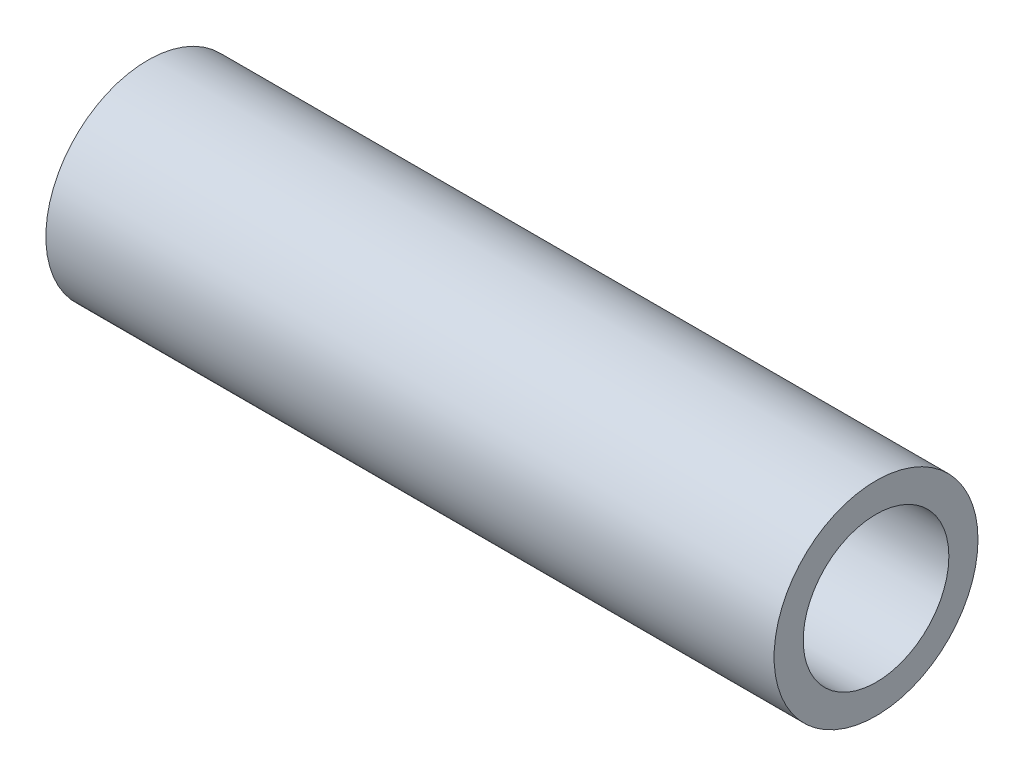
SolidWorks part; units mm, degrees
ref_plane "Plan1" through (0, 0, 0) normal (0, 0, 1) x (1, 0, 0)
ref_plane "Plan2" through (0, 0, 0) normal (0, 1, 0) x (1, 0, 0)
ref_plane "Plan3" through (0, 0, 0) normal (1, 0, 0) x (0, 0, -1)
sketch "Esquisse1" plane through (0, 0, 0) normal (1, 0, 0) x (0, 0, -1)
  circle A0 centre (0, 0) radius 3.5
  circle A1 centre (0, 0) radius 2.5
  dimension "D1" = 7
  dimension "D2" = 5
extrude "Base-Extrusion" add sketch "Esquisse1" along normal blind 25
